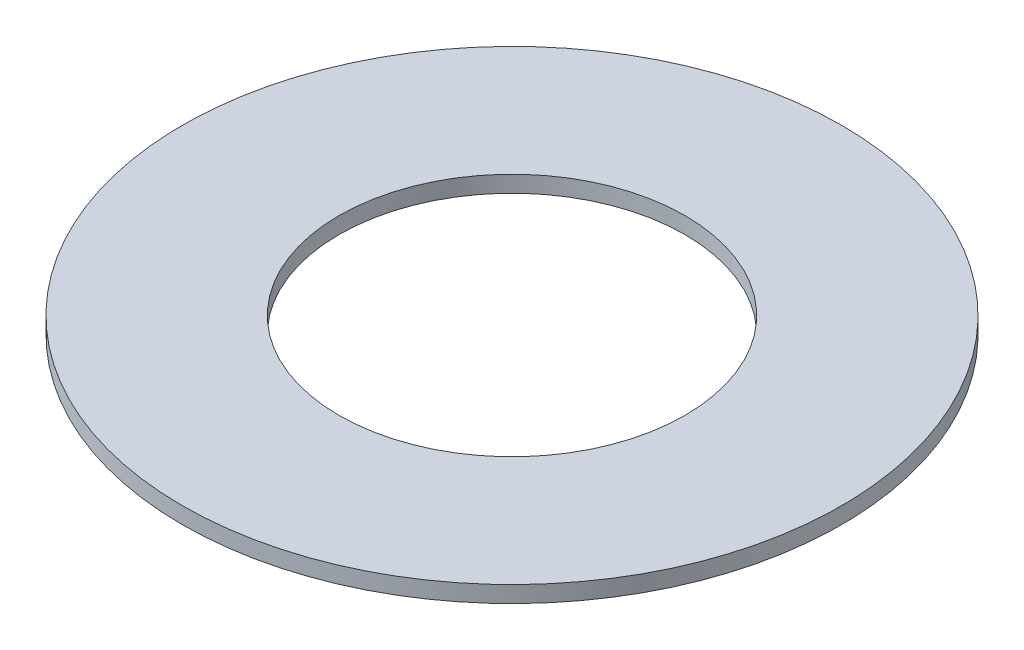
SolidWorks part; units mm, degrees
ref_plane "Płaszczyzna przednia" through (0, 0, 0) normal (0, 0, 1) x (1, 0, 0)
ref_plane "Płaszczyzna górna" through (0, 0, 0) normal (0, 1, 0) x (1, 0, 0)
ref_plane "Płaszczyzna prawa" through (0, 0, 0) normal (1, 0, 0) x (0, 0, -1)
sketch "Szkic1" plane through (0, 0, 0) normal (0, 1, 0) x (1, 0, 0)
  circle A0 centre (0, 0) radius 5.25
  circle A1 centre (0, 0) radius 10
  dimension "D1" = 20
  dimension "D2" = 10.5
extrude "Dodanie-wyciągnięcie1" add sketch "Szkic1" along normal blind 0.5
